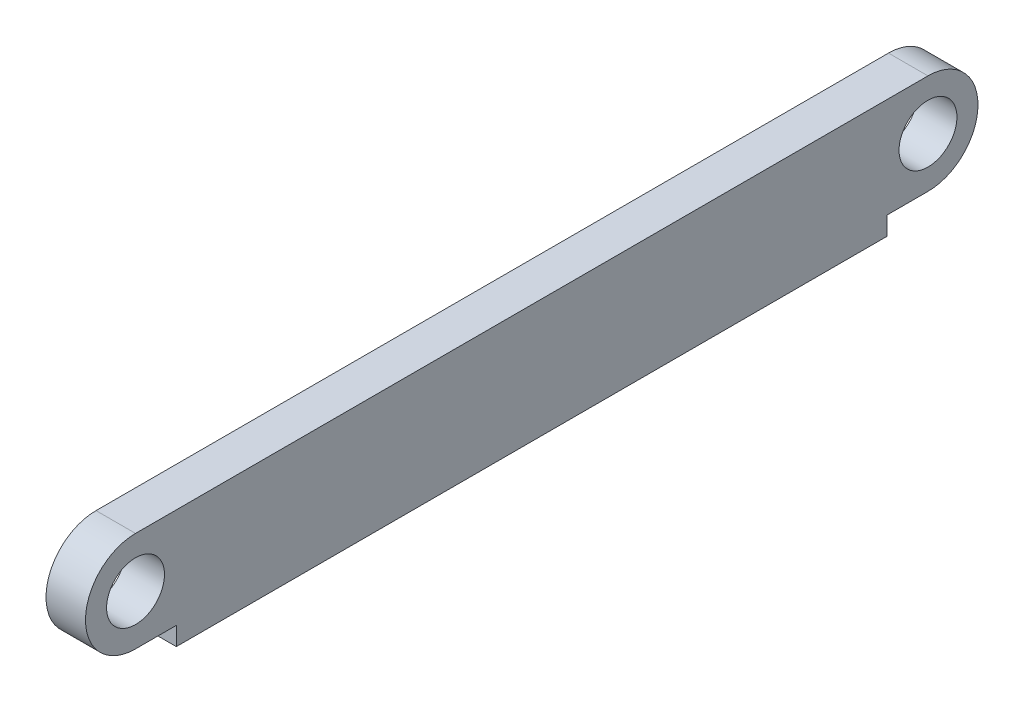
SolidWorks part; units mm, degrees
ref_plane "Front Plane" through (0, 0, 0) normal (0, 0, 1) x (1, 0, 0)
ref_plane "Top Plane" through (0, 0, 0) normal (0, 1, 0) x (1, 0, 0)
ref_plane "Right Plane" through (0, 0, 0) normal (1, 0, 0) x (0, 0, -1)
sketch "Sketch2" plane through (0, 0, 0) normal (1, 0, 0) x (0, 0, -1)
  line L1 (-18.5, 3.5) -> (35.5, 3.5)
  line L5 (-18.5, -5.5) -> (35.5, -5.5)
  line L6 (-18.5, 3.5) -> (-18.5, -5.5)
  line L20 (35.5, -5.5) -> (35.5, 3.5)
  point P0 (0, 0)
  dimension "D1" = 54
extrude "Boss-Extrude1" add sketch "Sketch2" along normal blind 3
sketch "Sketch3" plane through (0, 0, 0) normal (1, 0, 0) x (0, 0, -1)
  line L0 (-21.6, -0.3) -> (-18.2, -0.3) construction
  line L1 (-21.6, 3.5) -> (-18.2, 3.5)
  line L2 (-21.6, -4.1) -> (-18.2, -4.1)
  line L3 (35.2, -0.3) -> (38.6, -0.3) construction
  line L4 (35.2, 3.5) -> (38.6, 3.5)
  line L5 (35.2, -4.1) -> (38.6, -4.1)
  line L7 (35.5, 3.5) -> (-18.5, 3.5) construction
  arc A0 (-21.6, 3.5) -> (-21.6, -4.1) centre (-21.6, -0.3) ccw
  arc A1 (-18.2, -4.1) -> (-18.2, 3.5) centre (-18.2, -0.3) ccw
  arc A2 (35.2, 3.5) -> (35.2, -4.1) centre (35.2, -0.3) ccw
  arc A3 (38.6, -4.1) -> (38.6, 3.5) centre (38.6, -0.3) ccw
  point P2 (-19.9, -0.3)
  point P7 (36.9, -0.3)
  dimension "D3" = 3.8
  dimension "D4" = 3.8
  dimension "D1" = 3.4
  dimension "D2" = 3.4
  dimension "D5" = 1.4
  dimension "D6" = 1.4
extrude "Boss-Extrude2" add sketch "Sketch3" along normal blind 3
sketch "Sketch4" plane through (3, 0, 0) normal (1, 0, 0) x (0, 0, -1)
  circle A0 centre (-21.6, -0.3) radius 2.2
  arc A1 (-21.6, 3.5) -> (-21.6, -4.1) centre (-21.6, -0.3) ccw construction
  circle A2 centre (38.6, -0.3) radius 2.2
  arc A3 (38.6, -4.1) -> (38.6, 3.5) centre (38.6, -0.3) ccw construction
  dimension "D1" = 4.4
  dimension "D2" = 4.4
extrude "Cut-Extrude1" cut sketch "Sketch4" against normal through all
sketch "Sketch5" plane through (0, 0, 0) normal (-1, 0, 0) x (0, 0, 1)
  line L0 (-35.5, -5.5) -> (-35.5, -4.1) construction
  line L1 (-34.5, -4.75) -> (17.5, -4.75)
  line L2 (-34.5, -4.75) -> (-34.5, 2.75)
  line L3 (-34.5, 2.75) -> (17.5, 2.75)
  line L4 (17.5, -4.75) -> (17.5, 2.75)
  line L5 (18.5, -5.5) -> (-35.5, -5.5) construction
  line L6 (-38.6, 3.5) -> (21.6, 3.5) construction
  dimension "D1" = 52
  dimension "D2" = 1
  dimension "D3" = 0.75
  dimension "D4" = 0.75
extrude "Cut-Extrude2" cut sketch "Sketch5" against normal blind 0.75
